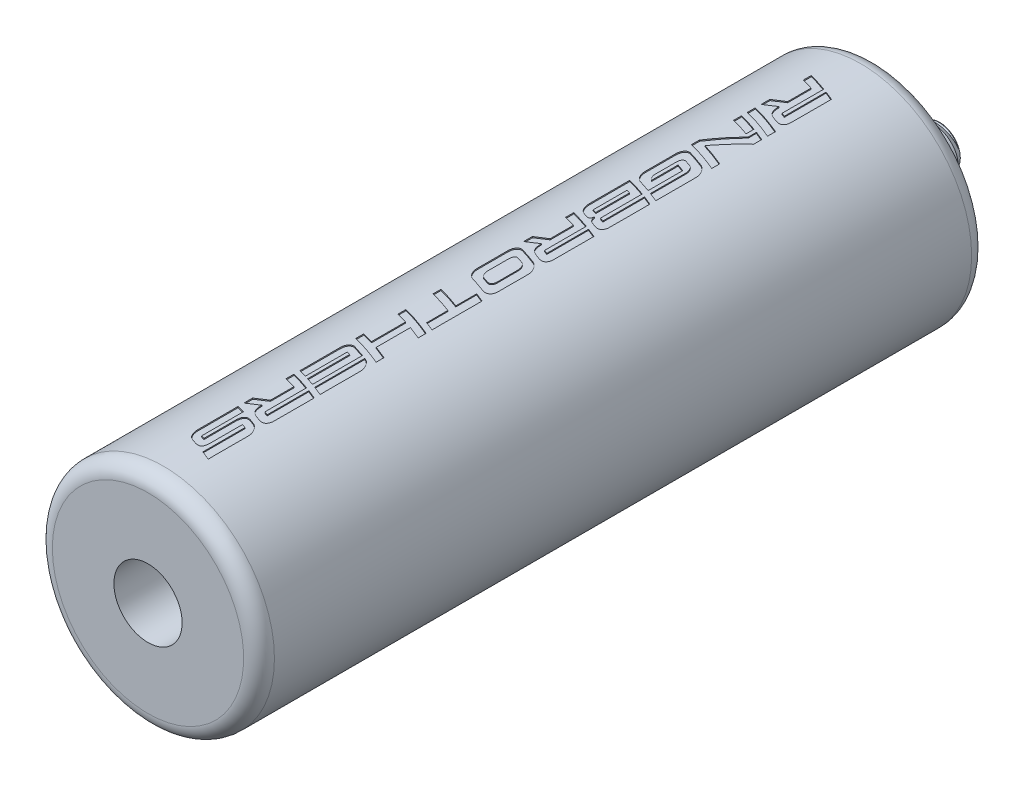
SolidWorks part; units mm, degrees
ref_plane "Front" through (0, 0, 0) normal (0, 0, 1) x (1, 0, 0)
ref_plane "Top" through (0, 0, 0) normal (0, 1, 0) x (1, 0, 0)
ref_plane "Right" through (0, 0, 0) normal (1, 0, 0) x (0, 0, -1)
sketch "Sketch1" plane through (0, 0, 0) normal (1, 0, 0) x (0, 0, -1)
  line L0 (-77.851, 0) -> (77.851, 0) construction
  line L1 (-77.851, 0) -> (-77.851, -25.4) construction
  line L2 (-27.813, 0) -> (-27.813, -13.716) construction
  line L3 (77.851, -25.4) -> (77.851, 0) construction
  line L4 (69.977, 0) -> (69.977, 13.716)
  line L5 (-19.939, 4.214) -> (-19.939, 13.716)
  line L6 (-69.977, 0) -> (-69.977, 4.064) construction
  line L7 (-69.977, 4.064) -> (-19.939, 4.064) construction
  line L8 (-19.939, 13.716) -> (69.977, 13.716)
  line L9 (-77.851, -25.4) -> (-19.939, -25.4) construction
  line L10 (-19.939, -25.4) -> (77.851, -25.4) construction
  line L11 (38.3667, 0) -> (69.977, 0)
  line L12 (-19.939, 4.214) -> (30.099, 4.214)
  line L13 (30.099, 4.214) -> (30.099, 0) construction
  line L14 (30.099, 4.214) -> (38.3667, 4.214)
  line L15 (38.3667, 4.214) -> (38.3667, 0)
  line L16 (-19.939, 4.214) -> (-19.939, 4.064) construction
  line L17 (-19.939, -13.716) -> (69.977, -13.716) construction
  line L18 (-69.977, -4.064) -> (-19.939, -4.064) construction
  line L19 (-19.939, 4.064) -> (-19.939, -13.716) construction
  line L20 (-19.939, -13.716) -> (-27.813, -13.716) construction
  line L21 (-19.939, -13.716) -> (-19.939, -25.4) construction
  point P9 (28.956, -25.4)
revolve "Revolve1" add sketch "Sketch1" angle 360 about L0
ref_plane "Plane1" through (0, 0, -28.956) normal (0, 0, 1) x (1, 0, 0)
fillet "Fillet2" radius 1.9004 2 edges at (13.716, 0, -69.977) (13.716, 0, 19.939)
sketch "Sketch2" plane through (0, 0, 0) normal (1, 0, 0) x (0, 0, -1)
  line L0 (77.851, 3) -> (69.977, 3)
  line L1 (69.977, 0) -> (129.3293, 0) construction
  line L2 (69.977, 0) -> (69.977, 3)
  line L3 (69.977, 0) -> (77.851, 0)
  line L5 (69.977, 0) -> (69.977, 13.716) construction
  line L8 (69.977, 0) -> (69.977, -3) construction
  line L10 (77.851, 3) -> (77.851, 0)
  line L12 (77.851, -3) -> (69.977, -3) construction
  line L13 (77.851, -25.4) -> (77.851, 0) construction
  dimension "Thread Dia" = 6
revolve "Revolve2" add sketch "Sketch2" angle 360 about L1
sketch "Sketch12" plane through (0, 0, 0) normal (1, 0, 0) x (0, 0, -1)
  line L0 (69.977, 3) -> (69.977, -3) construction
  line L1 (69.977, -3) -> (70.977, -3) construction
  line L2 (70.977, -3) -> (69.977, 3) construction
  line L3 (69.977, 3) -> (70.1003, 3.0205) construction
  line L4 (70.1003, 3.0205) -> (70.9634, 3.1644)
  line L5 (70.9634, 3.1644) -> (70.7441, 2.5791)
  line L6 (70.7441, 2.5791) -> (70.4975, 2.538)
  line L7 (70.4975, 2.538) -> (70.1003, 3.0205)
  line L8 (70.5318, 3.0925) -> (70.6208, 2.5586) construction
  line L9 (69.977, 3) -> (70.5473, 3) construction
  line L10 (70.5473, 3) -> (71.5473, -3) construction
  line L11 (71.5473, -3) -> (70.977, -3) construction
  line L12 (69.977, -0.1784) -> (72.1175, 0.1784) construction
  line L13 (77.851, -3) -> (69.977, -3) construction
  line L14 (77.851, 3) -> (69.977, 3) construction
  line L15 (69.977, 0) -> (69.977, 3) construction
  point P13 (71.0473, 0)
revolve "Cut-Revolve1" cut sketch "Sketch12" angle 360 about L12
sketch "Sketch13" plane through (0, 0, 0) normal (1, 0, 0) x (0, 0, -1)
  line L0 (76.8603, 3) -> (77.851, 3)
  line L1 (77.851, 3) -> (77.851, 2.538)
  line L2 (77.851, 2.538) -> (76.8603, 3)
  line L3 (77.851, 3) -> (69.977, 3) construction
  line L4 (77.851, 3) -> (77.851, 0) construction
  line L5 (70.4975, 2.538) -> (77.851, 2.538) construction
  line L6 (69.977, 0) -> (77.851, 0) construction
  line L7 (69.977, 0) -> (77.851, 0) construction
  dimension "D1" = 25
revolve "Cut-Revolve2" cut sketch "Sketch13" angle 360 about L7
pattern_linear "LPattern4" count 2 spacing 1 along (0, 0, 1) count 8 spacing 1 along (0, 0, -1) of "Cut-Revolve1"
combine bodies "Combine3" operation type add bodies to combine 143 108
sketch "Sketch15" plane through (0, 0, 0) normal (0, 1, 0) x (1, 0, 0)
  line L0 (0, 69.977) -> (0, -19.939) construction
  line L1 (11.8156, 69.977) -> (-11.8156, 69.977) construction
  line L2 (-11.8156, -19.939) -> (11.8156, -19.939) construction
  line L3 (-1.905, 69.977) -> (-1.905, -19.939) construction
  line L4 (1.905, 69.977) -> (1.905, -19.939) construction
  text T0 "RINGBROTHERS" font "Dodger" height 3.81
  dimension "D1" = 1.905
  dimension "D2" = 1.905
wrap "Wrap1" sketch "Sketch15" wrap type deboss source sketch "Sketch15" thickness 0.127 parameters "D1"=0.127
equation "\"D1@Fillet2\"=\"D9@Sketch1\"/5"
equation "\"D6@Sketch1\"=\"Thread Length@Sketch1\""
equation "\"D8@Sketch1\"=\"Thread Length@Sketch1\"*1.05"
equation "\"D1@Sketch12\"=\"Thread Pitch@Sketch12\"/8"
equation "\"D2@Sketch12\"=\"Thread Pitch@Sketch12\"/4"
equation "\"D4@Sketch12\"=\"Thread Pitch@Sketch12\""
equation "\"D3@LPattern4\"=\"Thread Pitch@Sketch12\""
equation "\"D4@LPattern4\"=\"Thread Pitch@Sketch12\""
equation "\"D2@LPattern4\"=\"Thread Length@Sketch1\"/\"Thread Pitch@Sketch12\""
